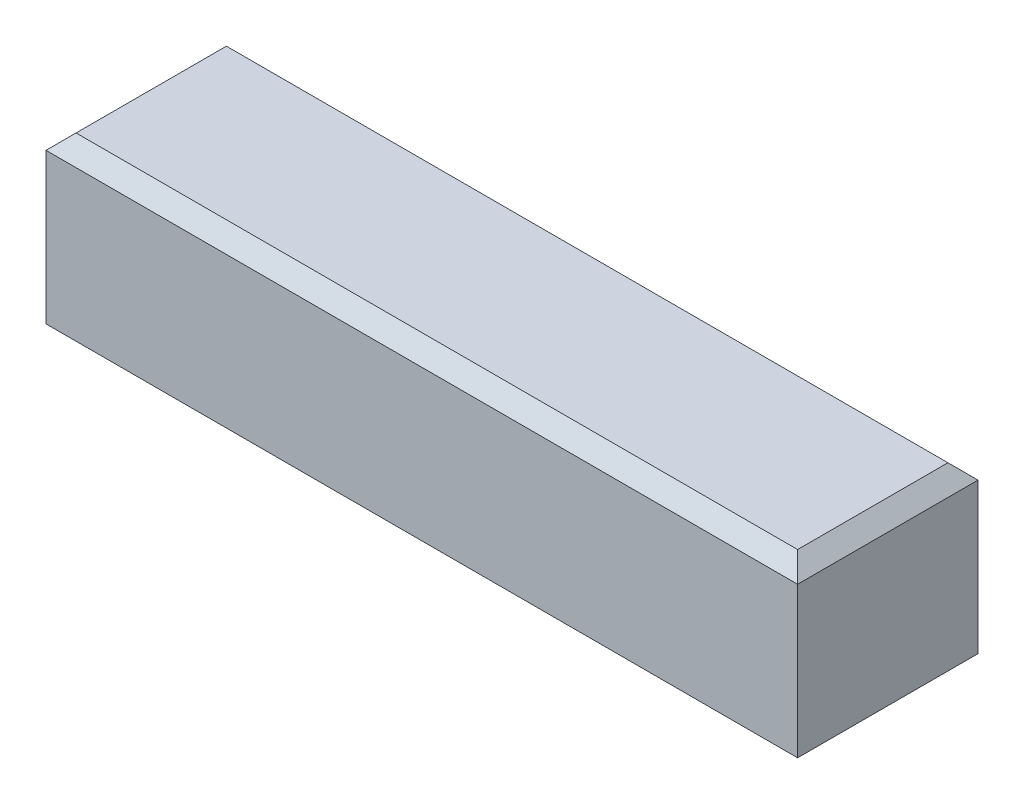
SolidWorks part; units mm, degrees
ref_plane "Plan1" through (0, 0, 0) normal (0, 0, 1) x (1, 0, 0)
ref_plane "Plan2" through (0, 0, 0) normal (0, 1, 0) x (1, 0, 0)
ref_plane "Plan3" through (0, 0, 0) normal (1, 0, 0) x (0, 0, -1)
sketch "Esquisse1" plane through (0, 0, 0) normal (0, 0, 1) x (1, 0, 0)
  line L0 (12.5, 3) -> (-12.5, -3) construction
  line L1 (-12.5, 3) -> (12.5, 3)
  line L2 (-12.5, 3) -> (-12.5, -3)
  line L3 (-12.5, -3) -> (12.5, -3)
  line L4 (12.5, 3) -> (12.5, -3)
  dimension "D1" = 6
  dimension "D2" = 25
extrude "Base-Extrusion" add sketch "Esquisse1" along normal blind 6
chamfer "Chanfrein1" distance 0.5 angle 45
